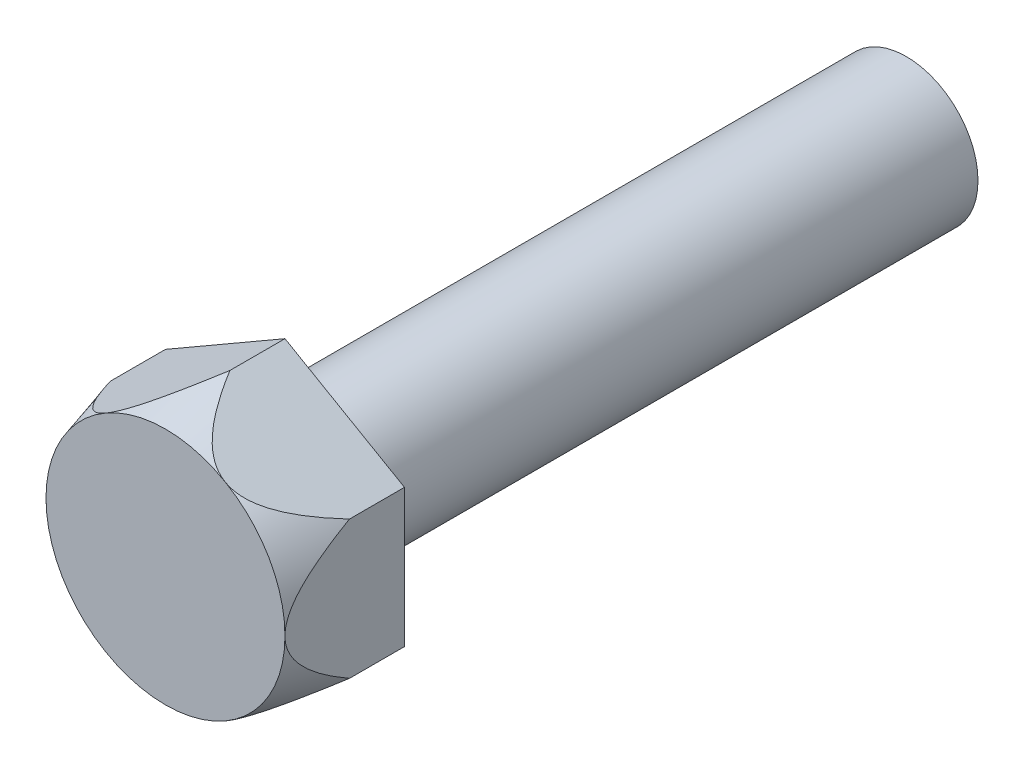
SolidWorks part; units mm, degrees
ref_plane "Front Plane" through (0, 0, 0) normal (0, 0, 1) x (1, 0, 0)
ref_plane "Top Plane" through (0, 0, 0) normal (0, 1, 0) x (1, 0, 0)
ref_plane "Right Plane" through (0, 0, 0) normal (1, 0, 0) x (0, 0, -1)
sketch "Sketch1" plane through (0, 0, 0) normal (0, 0, 1) x (1, 0, 0)
  line L1 (0, 2.8868) -> (-2.5, 1.4434)
  line L2 (-2.5, 1.4434) -> (-2.5, -1.4434)
  line L3 (-2.5, -1.4434) -> (0, -2.8868)
  line L4 (0, -2.8868) -> (2.5, -1.4434)
  line L5 (2.5, -1.4434) -> (2.5, 1.4434)
  line L6 (2.5, 1.4434) -> (0, 2.8868)
  circle A0 centre (0, 0) radius 2.5 construction
extrude "Boss-Extrude1" add sketch "Sketch1" along normal blind 2.5
sketch "Sketch2" plane through (0, 0, 2.5) normal (0, 0, 1) x (1, 0, 0)
  circle A0 centre (0, 0) radius 2.5
extrude "Cut-Extrude1" cut sketch "Sketch2" against normal blind 2.5 draft 16 flip side to cut
sketch "Sketch3" plane through (0, 0, 0) normal (0, 0, -1) x (-1, 0, 0)
  circle A0 centre (0, 0) radius 1.5
extrude "Boss-Extrude2" add sketch "Sketch3" along normal blind 13
